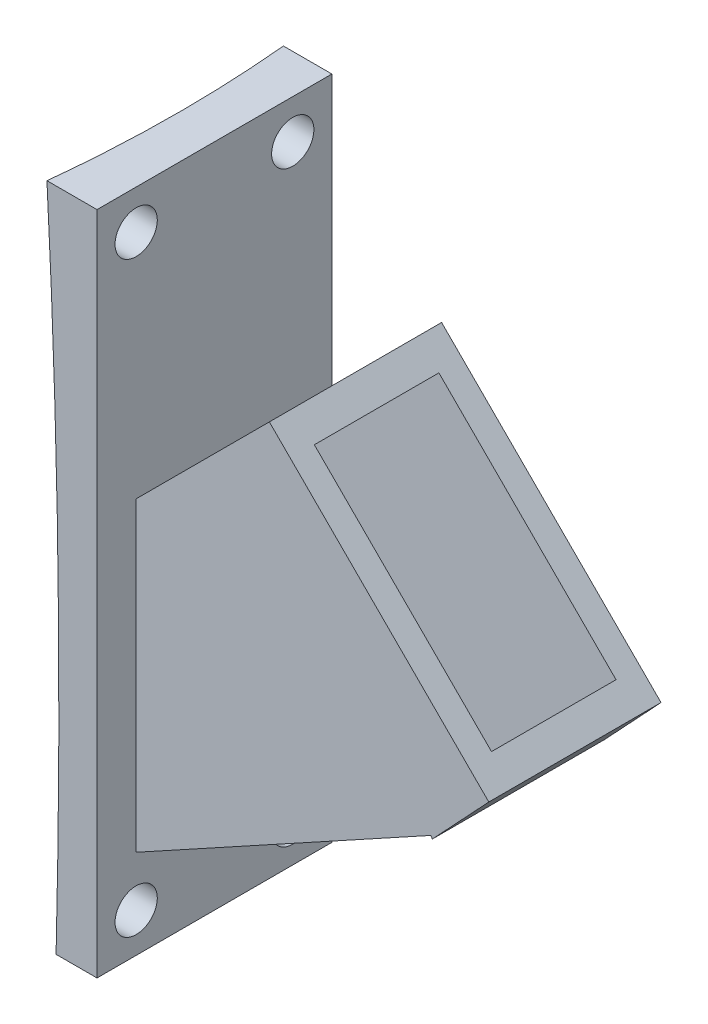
SolidWorks part; units mm, degrees
ref_plane "Front Plane" through (0, 0, 0) normal (0, 0, 1) x (1, 0, 0)
ref_plane "Top Plane" through (0, 0, 0) normal (0, 1, 0) x (1, 0, 0)
ref_plane "Right Plane" through (0, 0, 0) normal (1, 0, 0) x (0, 0, -1)
sketch "Sketch1" plane through (0, 0, 0) normal (1, 0, 0) x (0, 0, -1)
  line L1 (-7.62, -23.625) -> (7.62, -23.625)
  line L2 (-7.62, -23.625) -> (-7.62, 23.625)
  line L3 (-7.62, 23.625) -> (7.62, 23.625)
  line L4 (7.62, -23.625) -> (7.62, 23.625)
  line L5 (-7.62, -23.625) -> (7.62, 23.625) construction
  line L6 (-7.62, 23.625) -> (7.62, -23.625) construction
  point P0 (0, 0)
  dimension "D1" = 15.24
  dimension "D2" = 47.25
extrude "Boss-Extrude1" add sketch "Sketch1" along normal blind 29
sketch "Sketch8" plane through (0, 0, 0) normal (0, 1, 0) x (1, 0, 0)
  line L0 (8.89, -7.62) -> (8.89, 7.62) construction
  line L1 (29, -7.62) -> (0, -7.62) construction
  line L2 (29, 7.62) -> (0, 7.62) construction
  line L4 (0, -7.62) -> (0, 7.62) construction
  line L5 (8.89, 0) -> (-1363.98, 0) construction
  line L6 (-1363.98, 509.27) -> (-1363.98, -509.27)
  ellipse E0 centre (-1363.98, 0) end of major axis (8.89, 0) minor radius 509.27 (-1363.98, -509.27) -> (-1363.98, 509.27) ccw
  point P14 (-1363.98, 0)
  dimension "D1" = 8.89
  dimension "D2" = 1372.87
  dimension "D3" = 1018.54
revolve "Cut-Revolve1" cut sketch "Sketch8" angle 360 about L6
sketch "Sketch9" plane through (0, 0, 7.62) normal (0, 0, 1) x (1, 0, 0)
  line L0 (29, -23.625) -> (57.2937, -23.625)
  line L1 (57.2937, -23.625) -> (29, 23.625)
  line L2 (29, 23.625) -> (29, -23.625)
extrude "Boss-Extrude2" add sketch "Sketch9" against normal blind 15.24
ref_point "Point1"
sketch "Sketch11" plane through (0, 0, -7.62) normal (0, 0, -1) x (-1, 0, 0)
  line L0 (-8.533, 23.625) -> (-35.4738, 50.5658)
  line L1 (1364.0974, -1372.87) -> (-8.7726, 0) construction
  line L2 (-35.4738, 50.5658) -> (-71.0711, 14.9685)
  line L3 (-71.0711, 14.9685) -> (-48.5736, -9.0627)
  line L4 (-8.533, 23.625) -> (-29, 23.625)
  line L5 (-29, 23.625) -> (-48.5736, -9.0627)
  line L6 (-57.2937, -23.625) -> (-29, 23.625) construction
  dimension "D1" = 38.1
  dimension "D2" = 38.1
extrude "Boss-Extrude3" add sketch "Sketch11" against normal blind 27.94 from offset 6.35
sketch "Sketch12" plane through (43.0198, 43.0198, 0) normal (0.7071, 0.7071, 0) x (0, 0, -1)
  line L0 (13.97, 10.6717) -> (13.97, -39.6705) construction
  line L1 (-10.1003, 5.8206) -> (10.1003, 5.8206)
  line L2 (-10.1003, 5.8206) -> (-10.1003, -34.8194)
  line L3 (-10.1003, -34.8194) -> (10.1003, -34.8194)
  line L4 (10.1003, 5.8206) -> (10.1003, -34.8194)
  line L5 (-10.1003, 5.8206) -> (10.1003, -34.8194) construction
  line L6 (-10.1003, -34.8194) -> (10.1003, 5.8206) construction
  line L7 (-13.97, 10.6717) -> (13.97, 10.6717) construction
  point P0 (0, -14.4994)
  point P6 (10.1003, -14.4994)
  point P9 (13.97, -14.4994)
  point P10 (0, 5.8206)
  point P13 (0, 10.6717)
  dimension "D1" = 40.64
  dimension "D2" = 20.2006
sketch "Sketch13" plane through (0, 0, -7.62) normal (0, 0, -1) x (-1, 0, 0)
  line L0 (-61.6723, 5.5697) -> (-8.533, -23.625)
  line L1 (-8.533, -23.625) -> (-25.0146, -53.6243)
  line L2 (-25.0146, -53.6243) -> (-79.616, -23.6263)
  line L3 (-79.616, -23.6263) -> (-61.6723, 5.5697)
extrude "Cut-Extrude4" cut sketch "Sketch13" against normal through all both and the other way through all
sketch "Sketch15" plane through (0, 0, 7.62) normal (0, 0, 1) x (1, 0, 0)
  line L0 (8.533, -23.625) -> (45.2232, -3.4675) construction
  line L1 (13.867, 72.765) -> (1.133, 72.765)
  line L2 (13.867, 72.765) -> (13.867, -35.185)
  line L3 (13.867, -35.185) -> (1.133, -35.185)
  line L4 (1.133, 72.765) -> (1.133, -35.185)
  dimension "D1" = 12.7
  dimension "D2" = 107.95
  dimension "D3" = 5.334
extrude "Boss-Extrude4" add sketch "Sketch15" against normal blind 38.1 from offset 12.7
sketch "Sketch16" plane through (0, 0, 0) normal (0, 1, 0) x (1, 0, 0)
  line L0 (8.771, -44.3468) -> (8.771, 44.3468) construction
  line L1 (8.771, 0) -> (-1364.099, 0) construction
  line L2 (-1364.099, 509.27) -> (-1364.099, -509.27)
  ellipse E0 centre (-1364.099, 0) end of major axis (8.771, 0) minor radius 509.27 (-1364.099, -509.27) -> (-1364.099, 509.27) ccw
  point P6 (-1364.099, 0)
  dimension "D1" = 1372.87
  dimension "D2" = 1018.54
  dimension "D3" = 88.6936
revolve "Cut-Revolve2" cut sketch "Sketch16" angle 360 about L2
sketch "Sketch17" plane through (13.867, 0, 0) normal (1, 0, 0) x (0, 0, -1)
  line L0 (-20.32, -35.185) -> (-20.32, 72.765) construction
  line L1 (17.78, -35.185) -> (-20.32, -35.185) construction
  line L2 (17.78, -35.185) -> (17.78, 72.765) construction
  line L3 (17.78, 72.765) -> (-20.32, 72.765) construction
  circle A0 centre (-13.97, -28.835) radius 3.429
  circle A1 centre (-13.97, 66.415) radius 3.429
  circle A2 centre (11.43, 66.415) radius 3.429
  circle A3 centre (11.43, -28.835) radius 3.429
  dimension "D1" = 6.858
  dimension "D3" = 6.35
  dimension "D6" = 6.35
  dimension "D7" = 6.35
  dimension "D2" = 6.35
  dimension "D4" = 2
  dimension "D5" = 2
extrude "Cut-Extrude6" cut sketch "Sketch17" against normal through all
sketch "Sketch19" plane through (0, 0, 7.62) normal (0, 0, 1) x (1, 0, 0)
  line L4 (29, 23.625) -> (13.867, 23.625)
  line L5 (13.867, 23.625) -> (13.867, -20.6945)
  line L6 (13.867, -20.6945) -> (45.2232, -3.4675)
  line L7 (45.2232, -3.4675) -> (29, 23.625)
  line L8 (29, 23.625) -> (13.867, 23.625)
  line L9 (13.867, 23.625) -> (13.867, -20.6945)
  line L10 (13.867, -20.6945) -> (45.2232, -3.4675)
  line L11 (45.2232, -3.4675) -> (29, 23.625)
  dimension "D1" = 0
extrude "Boss-Extrude9" add sketch "Sketch19" along normal up to surface (6.35 mm away)
sketch "Sketch20" plane through (0, 0, -7.62) normal (0, 0, -1) x (-1, 0, 0)
  line L4 (-45.2232, -3.4675) -> (-13.867, -20.6945)
  line L5 (-13.867, -20.6945) -> (-13.867, 23.625)
  line L6 (-13.867, 23.625) -> (-29, 23.625)
  line L7 (-29, 23.625) -> (-45.2232, -3.4675)
  line L8 (-45.2232, -3.4675) -> (-13.867, -20.6945)
  line L9 (-13.867, -20.6945) -> (-13.867, 23.625)
  line L10 (-13.867, 23.625) -> (-29, 23.625)
  line L11 (-29, 23.625) -> (-45.2232, -3.4675)
  dimension "D1" = 0
extrude "Boss-Extrude10" add sketch "Sketch20" along normal up to surface (6.35 mm away)
extrude "Cut-Extrude8" cut sketch "Sketch12" against normal blind 38.1
